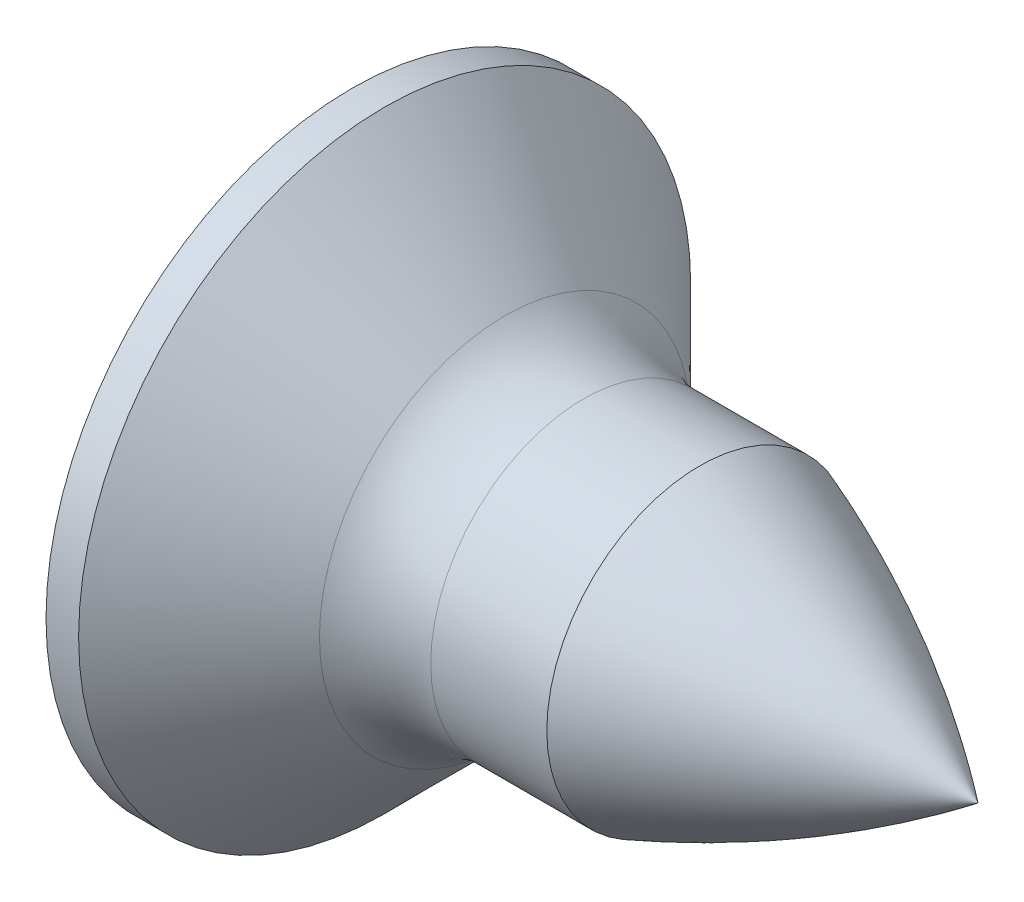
SolidWorks part; units mm, degrees
ref_plane "Front" through (0, 0, 0) normal (0, 0, 1) x (1, 0, 0)
ref_plane "Top" through (0, 0, 0) normal (0, 1, 0) x (1, 0, 0)
ref_plane "Right" through (0, 0, 0) normal (1, 0, 0) x (0, 0, -1)
sketch "Sketch1" plane through (0, 0, 0) normal (0, 0, 1) x (1, 0, 0)
  line L0 (-96.3852, 0) -> (11.3165, 0) construction
  line L1 (4.5, 0) -> (4.5, 1.1)
  line L2 (4.5, 1.1) -> (1.6657, 1.1)
  line L3 (1.9, 0.5946) -> (1.9, -0.97) construction
  line L4 (0.2343, 2.2) -> (0, 2.2)
  line L5 (4.5, 0) -> (0, 0)
  line L6 (1.1, 1.3343) -> (0.2343, 2.2)
  line L7 (0, 2.2) -> (0, 0)
  arc A0 (1.6657, 1.1) -> (1.1, 1.3343) centre (1.6657, 1.9) cw
  dimension "r" = 0.8
  dimension "D1" = 45
  dimension "st" = 2.2
  dimension "k" = 1.1
  dimension "l" = 4.5
  dimension "dk" = 4.4
  dimension "a" = 0.8
revolve "Base" add sketch "Sketch1" angle 360 about L0
sketch "Sketch2" plane through (0, -0.7629, -8.3818) normal (-1, 0, 0) x (0, 0, 1)
  line L0 (2.3136, 0.7629) -> (16.8132, 0.7629) construction
  line L1 (8.3818, 3.0086) -> (8.3818, -8.9204) construction
  line L2 (8.5818, 1.7629) -> (8.1818, 1.7629)
  line L3 (8.1818, 1.7629) -> (8.1818, 0.9629)
  line L4 (8.1818, 0.9629) -> (7.3818, 0.9629)
  line L5 (7.3818, 0.9629) -> (7.3818, 0.5629)
  line L6 (8.1818, 0.5629) -> (7.3818, 0.5629)
  line L7 (8.1818, -0.2371) -> (8.1818, 0.5629)
  line L8 (8.5818, -0.2371) -> (8.1818, -0.2371)
  line L9 (8.5818, -0.2371) -> (8.5818, 0.5629)
  line L10 (8.5818, 0.5629) -> (9.3818, 0.5629)
  line L11 (9.3818, 0.9629) -> (9.3818, 0.5629)
  line L12 (8.5818, 0.9629) -> (9.3818, 0.9629)
  line L13 (8.5818, 1.7629) -> (8.5818, 0.9629)
  point P5 (9.3818, 0.7629)
  point P11 (7.3818, 0.7629)
  point P15 (8.3818, -0.2371)
  point P20 (8.3818, 1.7629)
  dimension "D1" = 0.4
  dimension "m" = 2
extrude "CrossRecess" cut sketch "Sketch2" against normal blind 0.95
draft "Draft1" type of draft neutral plane draft angle 30 faces to draft 4 parameters "D1"=30
sketch "Sketch3" plane through (0, 0.5965, -8.6549) normal (-1, 0, 0) x (0, 0, 1)
  line L0 (8.6549, -0.5965) -> (16.919, 7.6677) construction
  line L2 (8.8549, -0.3965) -> (8.8549, -0.1965)
  line L4 (8.8549, -0.1965) -> (9.522, 0.2707)
  line L5 (9.0549, -0.3965) -> (9.522, 0.2707)
  line L6 (8.8549, -0.3965) -> (9.0549, -0.3965)
  line L7 (8.4549, -0.3965) -> (8.2549, -0.3965)
  line L8 (8.2549, -0.3965) -> (7.7877, 0.2707)
  line L9 (8.4549, -0.1965) -> (7.7877, 0.2707)
  line L10 (8.4549, -0.3965) -> (8.4549, -0.1965)
  line L11 (8.4549, -0.7965) -> (8.4549, -0.9965)
  line L12 (8.4549, -0.9965) -> (7.7877, -1.4636)
  line L13 (8.2549, -0.7965) -> (7.7877, -1.4636)
  line L14 (8.4549, -0.7965) -> (8.2549, -0.7965)
  line L15 (8.8549, -0.7965) -> (9.0549, -0.7965)
  line L16 (9.0549, -0.7965) -> (9.522, -1.4636)
  line L17 (8.8549, -0.9965) -> (9.522, -1.4636)
  line L18 (8.8549, -0.7965) -> (8.8549, -0.9965)
  line L19 (2.5867, -0.5965) -> (17.0862, -0.5965) construction
  line L20 (8.8549, -0.3965) -> (9.6549, -0.3965) construction
  line L22 (8.6549, 11.2261) -> (8.6549, -1) construction
  line L23 (10.9249, -0.5965) -> (-2.2894, -0.5965) construction
  dimension "D1" = 45
  dimension "D2" = 10
  dimension "D3" = 0.2
extrude "Cut-Extrude2" [suppressed] cut sketch "Sketch3" against normal up to surface (5.2 mm away)
sketch "Sketch4" plane through (0, 0, 0) normal (0, 1, 0) x (1, 0, 0)
  line L0 (33.3282, 0) -> (18.3612, 0) construction
  line L2 (2.9, -1.1) -> (3.7, -1.1)
  line L3 (3.7, -1.1) -> (4.5, -0.9)
  line L5 (4.5, -1.1) -> (4.5, 1.1) construction
  line L6 (2.9, -1.1) -> (2.9, -1.6)
  line L7 (2.9, -1.6) -> (4.5, -1.6)
  line L8 (4.5, -1.6) -> (4.5, -0.9)
  point P15 (3.7, -1.1)
  dimension "D1" = 2.2
  dimension "yf" = 1.6
  dimension "D2" = 0.8
  dimension "D3" = 0.2
  dimension "D4" = 0.5
revolve "Cut-Revolve1" [suppressed] cut sketch "Sketch4" angle 360 about L0
sketch "Sketch5" plane through (0, 0, 0) normal (0, 1, 0) x (1, 0, 0)
  line L0 (34.7407, 0) -> (11.4121, 0) construction
  line L2 (4.5, -1.1) -> (4.5, 1.1) construction
  line L3 (4.5, 0) -> (2.5, -1.1) construction
  line L6 (4.5, 0) -> (5, 0)
  line L7 (2.5, -1.1) -> (4.5, -1.1)
  line L8 (5, 0) -> (5, -1.1)
  line L9 (5, -1.1) -> (4.5, -1.1)
  arc A0 (4.5, 0) -> (2.5, -1.1) centre (-0.3159, 6.388) cw
  dimension "D1" = 8
  dimension "D2" = 0.5
  dimension "yc" = 2
  dimension "D3" = 2.2
revolve "Cut-Revolve6" cut sketch "Sketch5" angle 360 about L0
sketch "Sketch6" plane through (0, 0, 0) normal (0, 0, 1) x (1, 0, 0)
  line L0 (1.65, 1.6) -> (2.15, 1.6)
  line L1 (2.15, 1.6) -> (2.15, 1.1)
  line L2 (2.15, 1.1) -> (1.9, 0.667)
  line L3 (1.9, 0.667) -> (1.65, 1.1)
  line L4 (1.65, 1.1) -> (1.65, 1.6)
  line L5 (0, 0) -> (5.5511, 0) construction
  line L7 (1.1, 1.3343) -> (1.1, -1.3343) construction
  dimension "D1" = 0.5
  dimension "D2" = 0.8
  dimension "D3" = 2.2
revolve "Cut-Revolve10" [suppressed] cut sketch "Sketch6" angle 360 about L5
pattern_linear "LPattern10" [suppressed] count 4 spacing 0.6 along (1, 0, 0)
equation "\"D3@Sketch4\" = \"yf@Sketch4\" / 8"
equation "\"D2@ThreadCosmetic1\" = \"st@Sketch1\" - 1"
equation "\"D1@Sketch5\" = \"yc@Sketch5\" * 4"
equation "\"D3@Sketch5\" = \"st@Sketch1\""
equation "\"D2@Sketch4\" = \"yf@Sketch4\" / 2"
equation "\"D1@Sketch2\" = \"m@Sketch2\" / 5"
equation "\"D1@Sketch4\" = \"st@Sketch1\""
equation "\"D1@ThreadCosmetic1\" = \"l@Sketch1\" - \"k@Sketch1\" - \"a@Sketch1\""
equation "\"D3@Sketch3\" = \"m@Sketch2\" / 10"
equation "\"D1@Sketch6\" = (  \"st@Sketch1\" - \"D2@ThreadCosmetic1\" )  / 2"
equation "\"D2@Sketch6\" = \"a@Sketch1\""
equation "\"D3@LPattern10\" = \"D1@Sketch6\" * 1.2"
equation "\"D1@LPattern10\" = \"D1@ThreadCosmetic1\" / \"D3@LPattern10\" "
equation "\"D3@Sketch6\" = \"st@Sketch1\""
